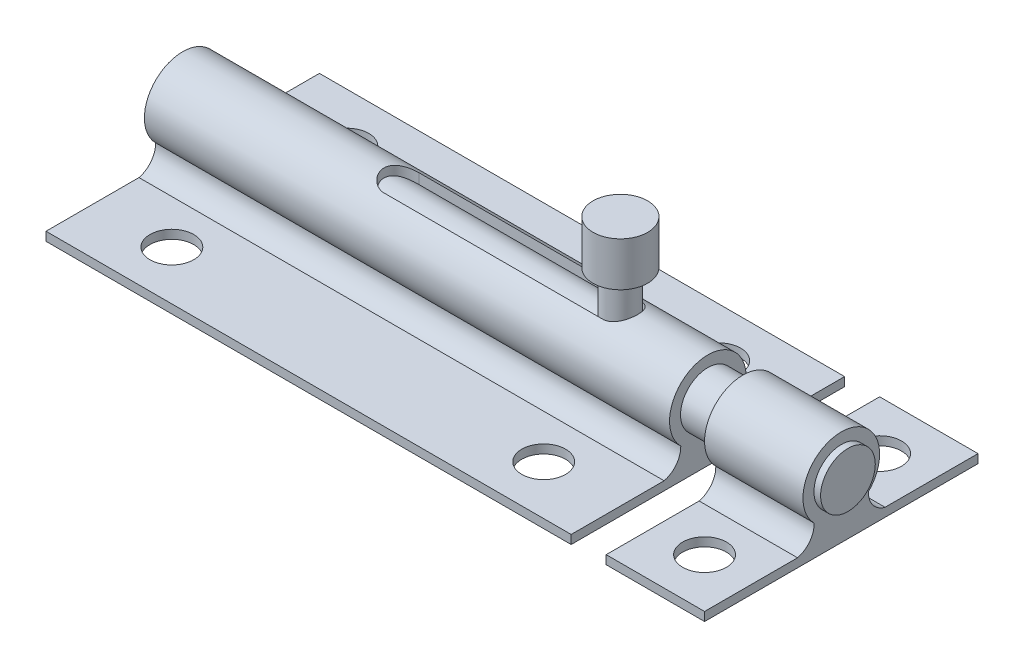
SolidWorks part; units mm, degrees
ref_plane "Front Plane" through (0, 0, 0) normal (0, 0, 1) x (1, 0, 0)
ref_plane "Top Plane" through (0, 0, 0) normal (0, 1, 0) x (1, 0, 0)
ref_plane "Right Plane" through (0, 0, 0) normal (1, 0, 0) x (0, 0, -1)
sketch "Sketch1" plane through (0, 0, 0) normal (0, 1, 0) x (1, 0, 0)
  line L0 (-38.1, 19.8374) -> (38.1, -19.8374) construction
  line L1 (-38.1, 19.8374) -> (38.1, 19.8374)
  line L2 (-38.1, 19.8374) -> (-38.1, -19.8374)
  line L3 (-38.1, -19.8374) -> (38.1, -19.8374)
  line L4 (38.1, 19.8374) -> (38.1, -19.8374)
  dimension "D1" = 76.2
  dimension "D2" = 39.6748
extrude "Boss-Extrude1" add sketch "Sketch1" along normal blind 1.27
sketch "Sketch2" plane through (0, 0, 0) normal (1, 0, 0) x (0, 0, -1)
  line L0 (0, 0) -> (0, 8.3566) construction
  line L1 (-19.8374, 1.27) -> (19.8374, 1.27) construction
  line L2 (-6.35, 1.27) -> (6.35, 1.27)
  line L3 (0, 8.3566) -> (-3.9334, 4.4232) construction
  line L4 (0, 8.3566) -> (3.9334, 4.4232) construction
  arc A0 (3.9334, 4.4232) -> (-3.9334, 4.4232) centre (0, 8.3566) ccw
  arc A1 (-6.35, 1.27) -> (-3.9334, 4.4232) centre (-7.1076, 4.3533) ccw
  arc A2 (3.9334, 4.4232) -> (6.35, 1.27) centre (7.1076, 4.3533) ccw
  point P8 (0, 1.27)
  dimension "D1" = 11.1252
  dimension "D2" = 1.524
  dimension "D5" = 3.175
  dimension "D3" = 12.7
  dimension "D4" = 45
extrude "Boss-Extrude2" add sketch "Sketch2" along normal mid plane 76.2
sketch "Sketch3" plane through (38.1, 0, 0) normal (1, 0, 0) x (0, 0, -1)
  circle A0 centre (0, 8.3566) radius 3.9688
  arc A1 (3.9334, 4.4232) -> (-3.9334, 4.4232) centre (0, 8.3566) ccw construction
  dimension "D1" = 7.9375
extrude "Boss-Extrude3" add sketch "Sketch3" along normal blind 20.32
sketch "Sketch4" plane through (38.1, 0, 0) normal (1, 0, 0) x (0, 0, -1)
  line L5 (-19.8374, 0) -> (19.8374, 0)
  line L6 (19.8374, 0) -> (19.8374, 1.27)
  line L7 (19.8374, 1.27) -> (6.35, 1.27)
  line L8 (-6.35, 1.27) -> (-19.8374, 1.27)
  line L9 (-19.8374, 1.27) -> (-19.8374, 0)
  line L10 (-19.8374, 0) -> (19.8374, 0)
  line L11 (19.8374, 0) -> (19.8374, 1.27)
  line L12 (19.8374, 1.27) -> (6.35, 1.27)
  line L13 (-6.35, 1.27) -> (-19.8374, 1.27)
  line L14 (-19.8374, 1.27) -> (-19.8374, 0)
  arc A3 (3.9334, 4.4232) -> (6.35, 1.27) centre (7.1076, 4.3533) ccw
  arc A4 (3.9334, 4.4232) -> (-3.9334, 4.4232) centre (0, 8.3566) ccw
  arc A5 (-6.35, 1.27) -> (-3.9334, 4.4232) centre (-7.1076, 4.3533) ccw
  arc A6 (3.9334, 4.4232) -> (6.35, 1.27) centre (7.1076, 4.3533) ccw
  arc A7 (3.9334, 4.4232) -> (-3.9334, 4.4232) centre (0, 8.3566) ccw
  arc A8 (-6.35, 1.27) -> (-3.9334, 4.4232) centre (-7.1076, 4.3533) ccw
  dimension "D1" = 0
extrude "Boss-Extrude4" add sketch "Sketch4" along normal blind 14.2748 from offset 5.08
sketch "Sketch5" plane through (0, 0, 0) normal (0, 1, 0) x (1, 0, 0)
  line L0 (0, 0) -> (25.4, 0) construction
  circle A0 centre (25.4, 0) radius 2.286
  dimension "D1" = 4.572
  dimension "D2" = 25.4
extrude "Boss-Extrude5" add sketch "Sketch5" along normal blind 24.9428
sketch "Sketch6" plane through (0, 24.9428, 0) normal (0, 1, 0) x (1, 0, 0)
  circle A0 centre (25.4, 0) radius 3.9624
  dimension "D1" = 7.9248
extrude "Boss-Extrude6" add sketch "Sketch6" against normal blind 6.4008
sketch "Sketch7" plane through (0, 1.27, 0) normal (0, 1, 0) x (1, 0, 0)
  line L0 (-26.9748, 12.7) -> (-26.9748, -12.7) construction
  line L1 (-26.9748, -12.7) -> (26.9748, -12.7) construction
  line L2 (26.9748, -12.7) -> (50.3174, -12.7) construction
  line L3 (50.3174, -12.7) -> (50.3174, 12.7) construction
  line L4 (26.9748, 12.7) -> (50.3174, 12.7) construction
  line L5 (26.9748, -12.7) -> (26.9748, 12.7) construction
  line L6 (0, -12.7) -> (0, 12.7) construction
  line L7 (26.9748, 12.7) -> (-26.9748, 12.7) construction
  line L8 (-38.1, 19.8374) -> (-38.1, 6.35) construction
  line L10 (50.3174, 19.8374) -> (50.3174, 12.7) construction
  line L11 (57.4548, 19.8374) -> (43.18, 19.8374) construction
  circle A0 centre (-26.9748, 12.7) radius 3.175
  circle A2 centre (26.9748, 12.7) radius 3.175
  circle A3 centre (50.3174, 12.7) radius 3.175
  circle A4 centre (50.3174, -12.7) radius 3.175
  circle A5 centre (26.9748, -12.7) radius 3.175
  circle A6 centre (-26.9748, -12.7) radius 3.175
  dimension "D1" = 6.35
  dimension "D2" = 25.4
  dimension "D3" = 11.1252
extrude "Cut-Extrude1" cut sketch "Sketch7" against normal through all
sketch "Sketch8" plane through (-38.1, 0, 0) normal (-1, 0, 0) x (0, 0, 1)
  circle A0 centre (0, 8.3566) radius 3.9688 construction
  circle A1 centre (0, 8.3566) radius 3.9688
extrude "Cut-Extrude2" cut sketch "Sketch8" against normal blind 19.05
sketch "Sketch9" plane through (0, 1.27, 0) normal (0, 1, 0) x (1, 0, 0)
  line L0 (-6.35, 0) -> (25.4, 0) construction
  line L1 (-6.35, 2.54) -> (25.4, 2.54)
  line L2 (-6.35, -2.54) -> (25.4, -2.54)
  arc A0 (-6.35, 2.54) -> (-6.35, -2.54) centre (-6.35, 0) ccw
  arc A1 (25.4, -2.54) -> (25.4, 2.54) centre (25.4, 0) ccw
  circle A2 centre (25.4, 0) radius 3.9624 construction
  circle A3 centre (25.4, 0) radius 2.286 construction
  circle A4 centre (25.4, 0) radius 2.286
  point P2 (9.525, 0)
  dimension "D2" = 2.54
  dimension "D1" = 31.75
extrude "Cut-Extrude4" cut sketch "Sketch9" against normal offset from surface (4.6929 mm away) 1.27 from offset 15.24
